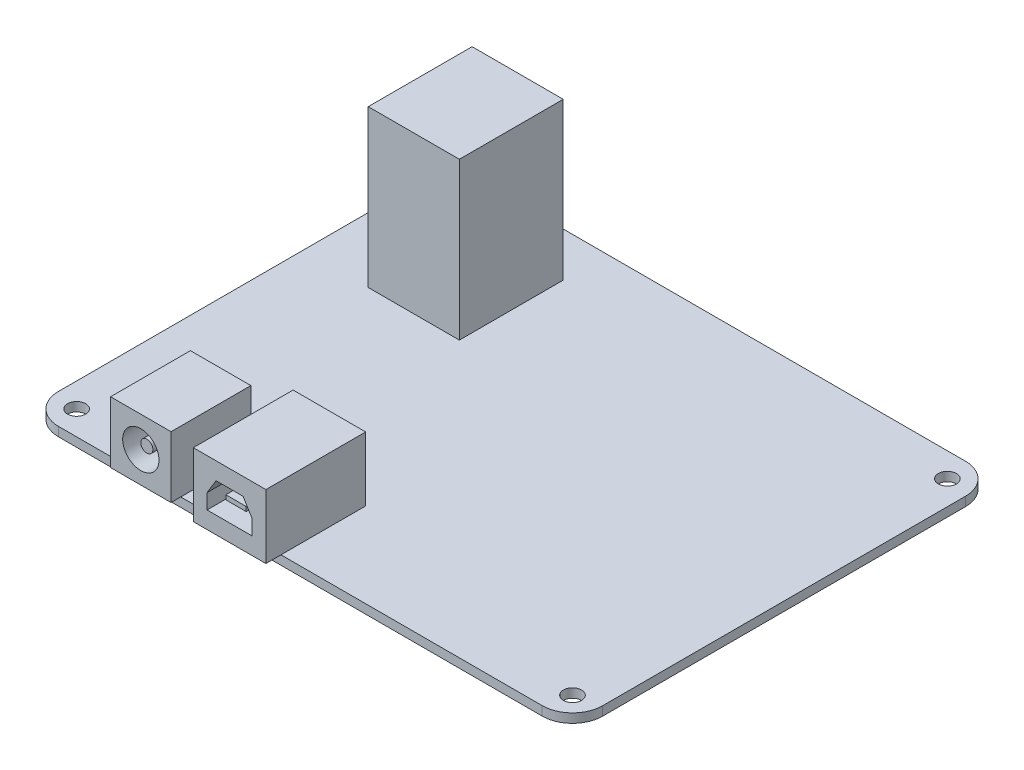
SolidWorks part; units mm, degrees
ref_plane "前视基准面" through (0, 0, 0) normal (0, 0, 1) x (1, 0, 0)
ref_plane "上视基准面" through (0, 0, 0) normal (0, 1, 0) x (1, 0, 0)
ref_plane "右视基准面" through (0, 0, 0) normal (1, 0, 0) x (0, 0, -1)
other "Configuration Table"
sketch "草图1" plane through (0, 0, 0) normal (0, 1, 0) x (1, 0, 0)
  line L1 (-45, 35) -> (45, 35)
  line L2 (-45, 35) -> (-45, -35)
  line L3 (-45, -35) -> (45, -35)
  line L4 (45, 35) -> (45, -35)
  line L5 (-45, 35) -> (45, -35) construction
  line L6 (-45, -35) -> (45, 35) construction
  point P0 (0, 0)
  dimension "D1" = 90
  dimension "D2" = 70
extrude "凸台-拉伸1" add sketch "草图1" along normal blind 1.5
fillet "圆角1" radius 5 4 edges at (-45, 0.75, -35) (-45, 0.75, 35) (45, 0.75, -35) (45, 0.75, 35)
sketch "草图2" plane through (0, 1.5, 0) normal (0, 1, 0) x (1, 0, 0)
  circle A0 centre (-41, 31) radius 1.5
  dimension "D1" = 31
  dimension "D2" = 41
  dimension "D3" = 3
extrude "切除-拉伸1" cut sketch "草图2" against normal through all
mirror "镜向1" about plane through (0, 0, 0) normal (1, 0, 0) of "切除-拉伸1"
sketch "草图3" plane through (0, 1.5, 0) normal (0, 1, 0) x (1, 0, 0)
  line L0 (-40, -35) -> (40, -35) construction
  line L1 (-29.78, -23.4) -> (-19.78, -23.4)
  line L2 (-29.78, -23.4) -> (-29.78, -36.6)
  line L3 (-29.78, -36.6) -> (-19.78, -36.6)
  line L4 (-19.78, -23.4) -> (-19.78, -36.6)
  line L5 (-45, 30) -> (-45, -30) construction
  dimension "D1" = 13.2
  dimension "D2" = 10
  dimension "D3" = 1.6
  dimension "D4" = 15.22
extrude "凸台-拉伸2" add sketch "草图3" along normal blind 10.15
sketch "草图4" plane through (0, 0, 36.6) normal (0, 0, 1) x (1, 0, 0)
  line L0 (-24.78, 11.65) -> (-24.78, 1.5) construction
  line L1 (-29.78, 11.65) -> (-19.78, 11.65) construction
  line L2 (-29.78, 1.5) -> (-19.78, 1.5) construction
  circle A0 centre (-24.78, 6.575) radius 3
  point P8 (-24.78, 6.575)
  dimension "D1" = 6
extrude "切除-拉伸2" cut sketch "草图4" against normal blind 5
sketch "草图5" plane through (0, 0, 31.6) normal (0, 0, 1) x (1, 0, 0)
  circle A0 centre (-24.78, 6.575) radius 1
  dimension "D1" = 2
extrude "凸台-拉伸3" add sketch "草图5" along normal blind 4
sketch "草图6" plane through (0, 1.5, 0) normal (0, 1, 0) x (1, 0, 0)
  line L0 (-19.78, -35) -> (40, -35) construction
  line L1 (-15.2, -21) -> (-3.2, -21)
  line L2 (-15.2, -21) -> (-15.2, -37.5)
  line L3 (-15.2, -37.5) -> (-3.2, -37.5)
  line L4 (-3.2, -21) -> (-3.2, -37.5)
  line L5 (-45, 30) -> (-45, -30) construction
  dimension "D1" = 12
  dimension "D2" = 2.5
  dimension "D3" = 29.8
  dimension "D4" = 16.5
extrude "凸台-拉伸4" add sketch "草图6" along normal blind 10.6
sketch "草图7" plane through (0, 0, 37.5) normal (0, 0, 1) x (1, 0, 0)
  line L0 (-9.2, 12.1) -> (-9.2, 1.5) construction
  line L1 (-15.2, 12.1) -> (-3.2, 12.1) construction
  line L2 (-15.2, 1.5) -> (-3.2, 1.5) construction
  line L3 (-6.9622, 9.248) -> (-11.4378, 9.248)
  line L4 (-11.4378, 9.248) -> (-12.926, 6.8)
  line L5 (-12.926, 6.8) -> (-12.926, 4.3156)
  line L6 (-12.926, 4.3156) -> (-5.474, 4.3156)
  line L7 (-5.474, 6.8) -> (-5.474, 4.3156)
  line L8 (-6.9622, 9.248) -> (-5.474, 6.8)
  point P12 (-9.2, 4.3156)
  point P14 (-9.2, 9.248)
extrude "切除-拉伸3" cut sketch "草图7" against normal blind 5
sketch "草图8" plane through (0, 0, 32.5) normal (0, 0, 1) x (1, 0, 0)
  line L1 (-10.8215, 7.048) -> (-7.4528, 7.048)
  line L2 (-10.8215, 7.048) -> (-10.8215, 6.3157)
  line L3 (-10.8215, 6.3157) -> (-7.4528, 6.3157)
  line L4 (-7.4528, 7.048) -> (-7.4528, 6.3157)
extrude "凸台-拉伸5" add sketch "草图8" along normal blind 4
sketch "草图9" plane through (0, 1.5, 0) normal (0, 1, 0) x (1, 0, 0)
  line L1 (-34.2732, 27.6756) -> (-19.2027, 27.6756)
  line L2 (-34.2732, 27.6756) -> (-34.2732, 10.4985)
  line L3 (-34.2732, 10.4985) -> (-19.2027, 10.4985)
  line L4 (-19.2027, 27.6756) -> (-19.2027, 10.4985)
extrude "凸台-拉伸6" add sketch "草图9" along normal blind 25.9
